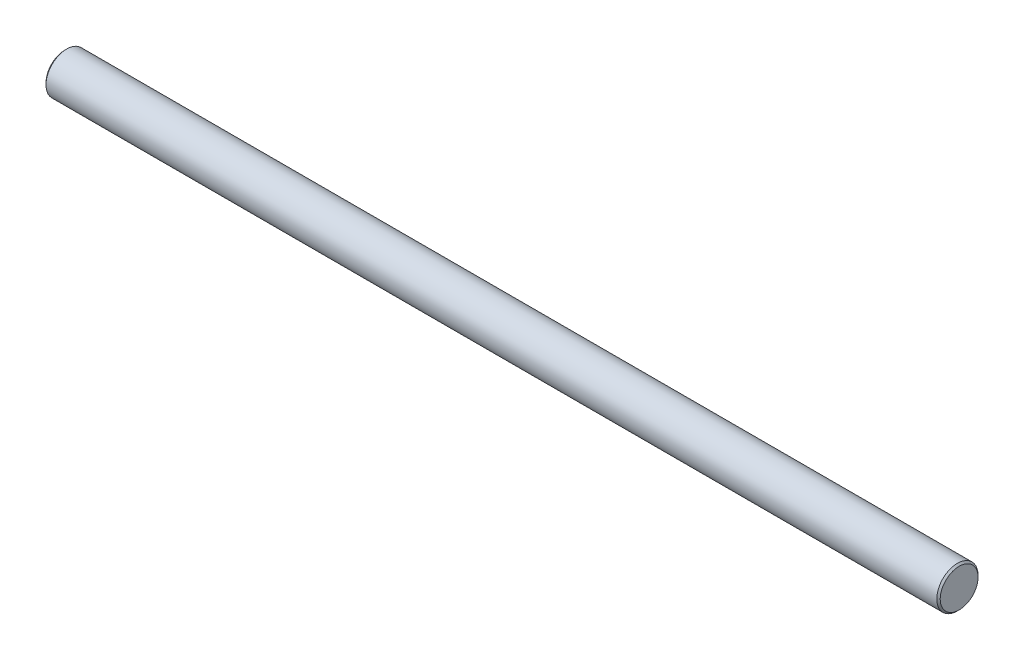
SolidWorks part; units mm, degrees
ref_plane "Plan de face" through (0, 0, 0) normal (0, 0, 1) x (1, 0, 0)
ref_plane "Plan de dessus" through (0, 0, 0) normal (0, 1, 0) x (1, 0, 0)
ref_plane "Plan de droite" through (0, 0, 0) normal (1, 0, 0) x (0, 0, -1)
sketch "Esquisse1" plane through (0, 0, 0) normal (0, 0, 1) x (1, 0, 0)
  line L0 (-16.2474, 0) -> (19.0817, 0) construction
  line L2 (-40, 0) -> (90, 0)
  line L3 (-40, 0) -> (-40, 3)
  line L4 (-40, 3) -> (90, 3)
  line L5 (90, 0) -> (90, 3)
  dimension "D1" = 6
  dimension "D2" = 40
  dimension "D3" = 130
revolve "Révolution1" add sketch "Esquisse1" angle 360 about L0
chamfer "Chanfrein1" distance 0.25 angle 45 2 edges at (90, 0, 3) (-40, 0, 3)
